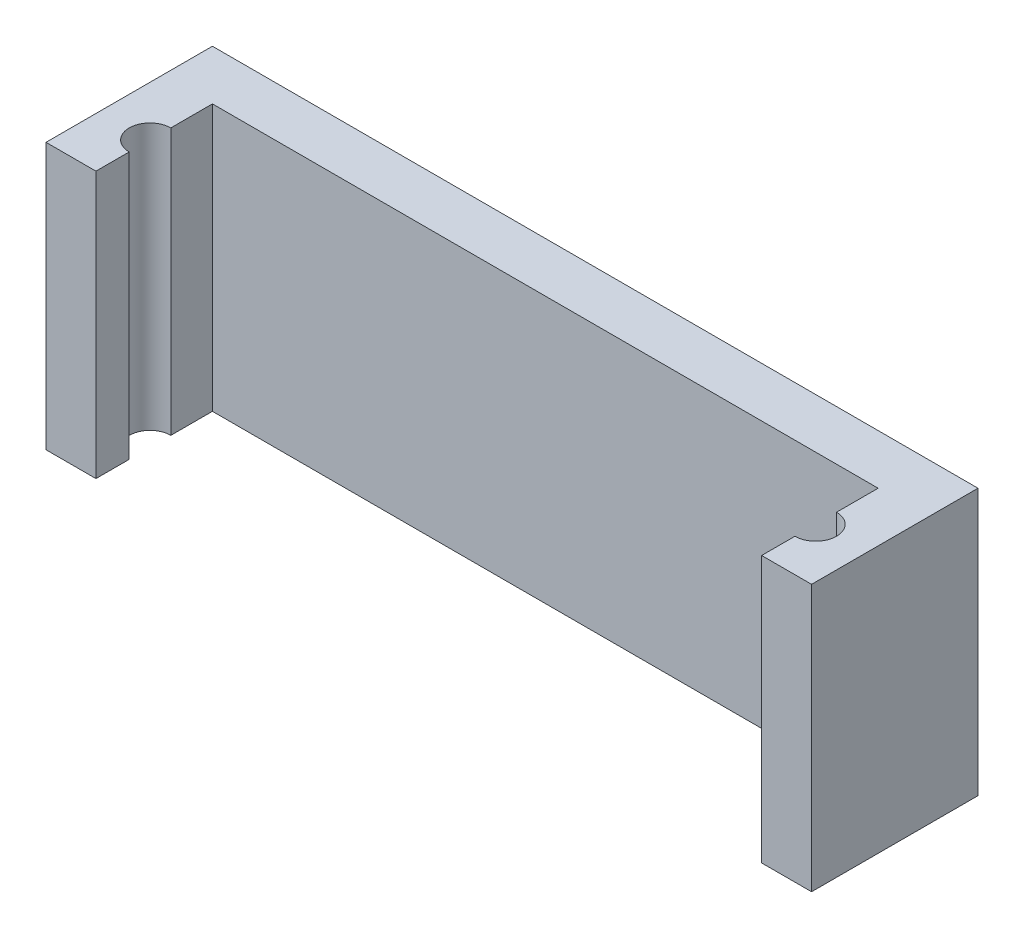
SolidWorks part; units mm, degrees
ref_plane "Front Plane" through (0, 0, 0) normal (0, 0, 1) x (1, 0, 0)
ref_plane "Top Plane" through (0, 0, 0) normal (0, 1, 0) x (1, 0, 0)
ref_plane "Right Plane" through (0, 0, 0) normal (1, 0, 0) x (0, 0, -1)
sketch "Sketch1" plane through (0, 0, 0) normal (0, 1, 0) x (1, 0, 0)
  line L0 (1.905, 0) -> (1.905, -1.27)
  line L1 (1.905, 3.175) -> (27.305, 3.175)
  line L2 (14.605, 3.175) -> (14.605, 0.7938) construction
  line L3 (0, 0) -> (0, 5.08)
  line L4 (0, 5.08) -> (29.21, 5.08)
  line L5 (29.21, -1.27) -> (29.21, 0)
  line L6 (27.305, -1.27) -> (29.21, -1.27)
  line L7 (1.905, 1.5875) -> (1.905, 3.175)
  line L8 (1.905, -1.27) -> (0, -1.27)
  line L9 (0, -1.27) -> (0, 0)
  line L10 (27.305, 1.5875) -> (27.305, 3.175)
  line L11 (29.21, 0) -> (29.21, 5.08)
  line L12 (27.305, 0) -> (27.305, -1.27)
  arc A0 (1.905, 1.5875) -> (1.905, 0) centre (1.905, 0.7938) ccw
  arc A1 (27.305, 1.5875) -> (27.305, 0) centre (27.305, 0.7938) cw
  point P15 (14.605, 5.715)
  point P16 (14.605, 5.08)
  point P21 (14.605, 5.08)
extrude "Extrude1" add sketch "Sketch1" along normal blind 10.16
